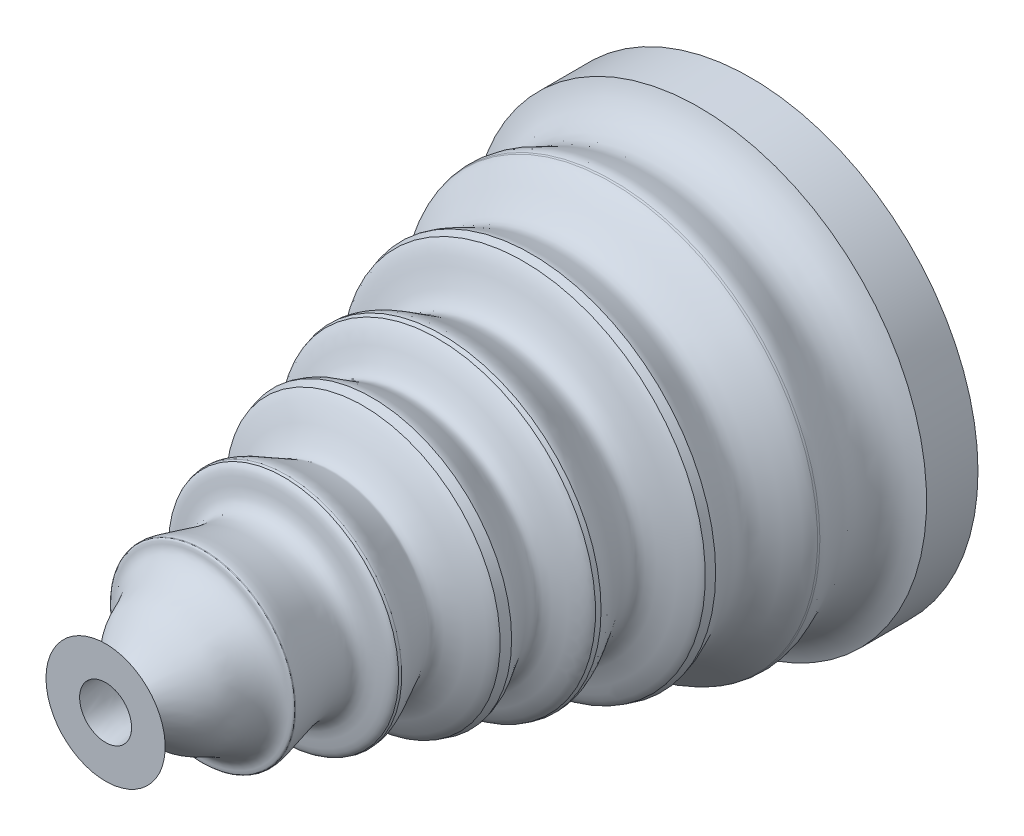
SolidWorks part; units mm, degrees
ref_plane "Plan de face" through (0, 0, 0) normal (0, 0, 1) x (1, 0, 0)
ref_plane "Plan de dessus" through (0, 0, 0) normal (0, 1, 0) x (1, 0, 0)
ref_plane "Plan de droite" through (0, 0, 0) normal (1, 0, 0) x (0, 0, -1)
sketch "Esquisse1" plane through (0, 0, 0) normal (0, 0, 1) x (1, 0, 0)
  circle A0 centre (0, 0) radius 17.5
  circle A1 centre (0, 0) radius 12.5
  dimension "D1" = 35
  dimension "D2" = 25
extrude "Extrusion1" add sketch "Esquisse1" along normal blind 5
ref_plane "Plan1" through (0, 0, 49.66) normal (0, 0, 1) x (1, 0, 0)
sketch "Esquisse2" plane through (0, 0, 49.66) normal (0, 0, 1) x (1, 0, 0)
  circle A1 centre (0, 0) radius 5
  dimension "D2" = 10
sketch "Esquisse3" plane through (0, 0, 5) normal (0, 0, 1) x (1, 0, 0)
  circle A0 centre (0, 0) radius 17.5 construction
  circle A1 centre (0, 0) radius 17.5
loft "Lissage1" add profiles "Esquisse3", "Esquisse2"
sketch "Esquisse5" plane through (0, 0, 5) normal (0, 0, -1) x (-1, 0, 0)
  circle A0 centre (0, 0) radius 15
  dimension "D1" = 30
sketch "Esquisse7" plane through (0, 0, 49.66) normal (0, 0, 1) x (1, 0, 0)
  circle A0 centre (0, 0) radius 2
  dimension "D1" = 4
loft "Enlèvement de matière-Lissage1" cut profiles "Esquisse7", "Esquisse5"
sketch "Esquisse8" plane through (0, 0, 0) normal (0, 1, 0) x (1, 0, 0)
  line L0 (5, -49.66) -> (17.5, -5) construction
  line L1 (-55, -49.66) -> (55, -49.66) construction
  line L2 (17.8258, -3.8361) -> (27.0978, -7.5628)
  line L3 (27.0978, -7.5628) -> (13.5117, -49.66)
  line L4 (13.5117, -49.66) -> (4.5874, -49.66)
  spline S0 degree 3 poles (17.8258, -3.8361) (17.0142, -4.1318) (15.6413, -4.6321) (14.4633, -7.7765) (17.3283, -10.9503) (11.4723, -13.8549) (16.1965, -17.9817) (7.837, -18.687) (14.6713, -24.5965) (7.082, -25.4076) (13.1612, -30.0213) (7.4981, -31.145) (7.2304, -32.4932) (10.8838, -37.4574) (4.477, -35.2191) (8.2332, -43.8015) (6.05, -41.6613) (3.9732, -47.0845) (-0.6441, -49.262) (4.5874, -49.66) knots 0 0 0 0 0.097318 0.164637 0.249587 0.343652 0.439128 0.525529 0.624716 0.695857 0.779594 0.841182 0.841182 0.867476 0.896379 0.922329 0.940471 0.940471 0.954596 0.954596 0.954596 0.954596
revolve "Enlèvement de matière-Révolution1" cut sketch "Esquisse8" angle 360 about axis through (0, 0, 49.66) along (0, 0, -1)
